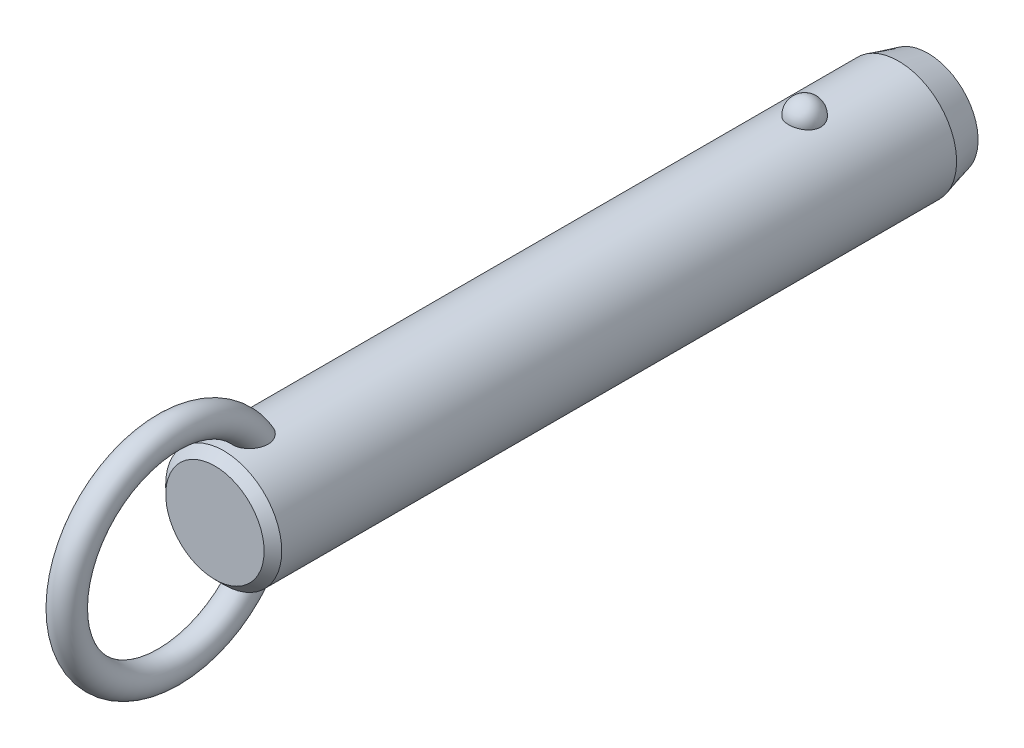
SolidWorks part; units mm, degrees
ref_plane "Front Plane" through (0, 0, 0) normal (0, 0, 1) x (1, 0, 0)
ref_plane "Top Plane" through (0, 0, 0) normal (0, 1, 0) x (1, 0, 0)
ref_plane "Right Plane" through (0, 0, 0) normal (1, 0, 0) x (0, 0, -1)
sketch "Sketch2" plane through (0, 0, 0) normal (0, 0, 1) x (1, 0, 0)
  circle A0 centre (0, 0) radius 7.9
  point P3 (0, 7.9)
  dimension "D1" = 15.8
extrude "Boss-Extrude1" add sketch "Sketch2" along normal blind 68.6
sketch "Sketch3" plane through (0, 0, 0) normal (0, 0, -1) x (-1, 0, 0)
  circle A0 centre (0, 0) radius 7.9
  dimension "D1" = 15.8
extrude "Boss-Extrude2" add sketch "Sketch3" along normal blind 19
chamfer "Chamfer1" distance 4 angle 15 1 edges at (-7.9, 0, -19)
sketch "Sketch12" plane through (0, 0, 0) normal (1, 0, 0) x (0, 0, -1)
  line L0 (-68.6, 7.9) -> (-68.6, -7.9) construction
  point P0 (-68.6, 0)
sketch "Sketch13" plane through (0, 0, 0) normal (1, 0, 0) x (0, 0, -1)
  circle A0 centre (-84.45, 0) radius 15.85
  point P2 (-68.6, 0)
  dimension "D1" = 31.7
sketch "Sketch14" plane through (0, 0, 0) normal (0, 1, 0) x (1, 0, 0)
  circle A0 centre (0, -70.6) radius 2
  point P2 (0, -68.6)
  dimension "D1" = 4
sweep "Sweep1" add profiles "Sketch14" path "Sketch13"
sketch "Sketch15" plane through (0, 0, 68.6) normal (0, 0, 1) x (1, 0, 0)
  circle A0 centre (0, 0) radius 7.9
  dimension "D1" = 15.8
extrude "Boss-Extrude3" add sketch "Sketch15" along normal blind 9.52
chamfer "Chamfer2" distance 1.2 angle 45 1 edges at (7.9, 0, 78.12)
sketch "Sketch18" plane through (0, 0, 0) normal (1, 0, 0) x (0, 0, -1)
  line L0 (15, 7.9) -> (-70.7091, 7.9) construction
  line L1 (2.2, 10.1) -> (2.2, 5.7)
  line L2 (-70.7091, -7.9) -> (15, -7.9) construction
  arc A0 (2.2, 10.1) -> (2.2, 5.7) centre (2.2, 7.9) ccw
  point P4 (0, 7.9)
  dimension "D1" = 18
revolve "Revolve1" add sketch "Sketch18" angle 360 about L1
